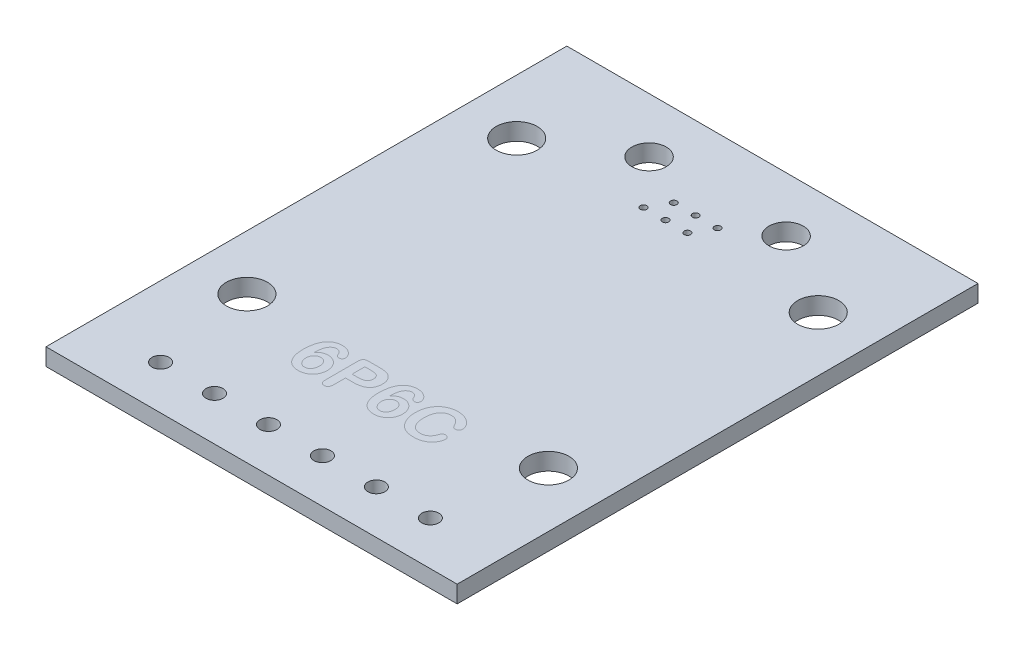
SolidWorks part; units mm, degrees
ref_plane "Front Plane" through (0, 0, 0) normal (0, 0, 1) x (1, 0, 0)
ref_plane "Top Plane" through (0, 0, 0) normal (0, 1, 0) x (1, 0, 0)
ref_plane "Right Plane" through (0, 0, 0) normal (1, 0, 0) x (0, 0, -1)
sketch "Sketch1" plane through (0, 0, 0) normal (0, 1, 0) x (1, 0, 0)
  line L0 (19.05, 48.26) -> (19.05, 0) construction
  line L1 (0, 0) -> (38.1, 0)
  line L2 (0, 0) -> (0, 48.26)
  line L3 (0, 48.26) -> (38.1, 48.26)
  line L4 (38.1, 0) -> (38.1, 48.26)
  circle A0 centre (5.08, 13.535) radius 1.905
  circle A1 centre (5.08, 38.535) radius 1.905
  circle A2 centre (33.02, 13.535) radius 1.905
  circle A3 centre (33.02, 38.535) radius 1.905
  circle A4 centre (5.08, 26.035) radius 1.905 construction
  circle A5 centre (33.02, 26.035) radius 1.905 construction
  dimension "D3" = 5.08
  dimension "D4" = 12.5
  dimension "D5" = 12.5
  dimension "D6" = 3.81
  dimension "D7" = 26.035
  dimension "D1" = 38.1
  dimension "D2" = 48.26
extrude "Boss-Extrude1" add sketch "Sketch1" against normal blind 1.5875
sketch "Sketch2" plane through (0, 0, 0) normal (0, 1, 0) x (1, 0, 0)
  line L1 (0, 0) -> (38.1, 0) construction
  line L2 (6.55, 4.064) -> (11.55, 4.064) construction
  line L3 (19.05, 48.26) -> (19.05, 0) construction
  line L4 (38.1, 48.26) -> (0, 48.26) construction
  line L5 (16.55, 4.064) -> (21.55, 4.064) construction
  circle A0 centre (6.55, 4.064) radius 0.7874
  circle A1 centre (11.55, 4.064) radius 0.7874
  circle A2 centre (16.55, 4.064) radius 0.7874
  circle A3 centre (21.55, 4.064) radius 0.7874
  circle A4 centre (26.55, 4.064) radius 0.7874
  circle A5 centre (31.55, 4.064) radius 0.7874
  point P2 (19.05, 4.064)
  dimension "D2" = 4.064
  dimension "D5" = 1.5748
  dimension "D4" = 5
  dimension "D3" = 6
extrude "screwHoles" cut sketch "Sketch2" against normal through all
sketch "Sketch3" plane through (0, 0, 0) normal (0, 1, 0) x (1, 0, 0)
  line L2 (19.05, 48.26) -> (19.05, 0) construction
  line L3 (38.1, 48.26) -> (0, 48.26) construction
  line L4 (0, 0) -> (38.1, 0) construction
  circle A0 centre (12.7, 43.18) radius 1.59
  circle A1 centre (25.4, 43.18) radius 1.59
  dimension "D1" = 3.18
  dimension "D3" = 5.08
  dimension "D2" = 12.7
extrude "Cut-Extrude2" cut sketch "Sketch3" against normal through all
sketch "Sketch4" plane through (0, 0, 0) normal (0, 1, 0) x (1, 0, 0)
  line L0 (0, 9.8298) -> (38.1, 9.8298) construction
  line L1 (0, 48.26) -> (0, 0) construction
  line L2 (38.1, 0) -> (38.1, 48.26) construction
  line L3 (0, 0) -> (38.1, 0) construction
  text T0 "6P6C" font "Arial Rounded MT Bold" height in points 16
  dimension "D1" = 9.8298
ref_plane "Plane2" [suppressed] through (19.05, 0, 0) normal (1, 0, 0) x (0, 0, -1)
sketch "Sketch5" plane through (0, -1.5875, 0) normal (0, -1, 0) x (1, 0, 0)
  line L0 (16.51, -38.6715) -> (16.51, -39.0525) construction
  line L1 (16.2814, -38.6715) -> (16.7386, -38.6715) construction
  line L2 (16.7386, -39.0525) -> (16.2814, -39.0525) construction
  line L3 (18.542, -38.6715) -> (18.542, -39.0525) construction
  line L4 (18.7706, -38.6715) -> (18.3134, -38.6715) construction
  line L5 (18.7706, -39.0525) -> (18.3134, -39.0525) construction
  line L6 (20.574, -38.6715) -> (20.574, -39.0525) construction
  line L7 (20.8026, -38.6715) -> (20.3454, -38.6715) construction
  line L8 (20.8026, -39.0525) -> (20.3454, -39.0525) construction
  line L9 (17.526, -40.4495) -> (17.526, -40.8305) construction
  line L10 (17.2974, -40.4495) -> (17.7546, -40.4495) construction
  line L11 (17.7546, -40.8305) -> (17.2974, -40.8305) construction
  line L12 (19.558, -40.4495) -> (19.558, -40.8305) construction
  line L13 (19.7866, -40.4495) -> (19.3294, -40.4495) construction
  line L14 (19.7866, -40.8305) -> (19.3294, -40.8305) construction
  line L15 (21.59, -40.4495) -> (21.59, -40.8305) construction
  line L16 (21.8186, -40.4495) -> (21.3614, -40.4495) construction
  line L17 (21.8186, -40.8305) -> (21.3614, -40.8305) construction
  line L18 (16.51, -39.0525) -> (16.7386, -39.0525) construction
  circle A0 centre (16.51, -38.862) radius 0.2976
  circle A1 centre (18.542, -38.862) radius 0.2976
  circle A2 centre (20.574, -38.862) radius 0.2976
  circle A3 centre (17.526, -40.64) radius 0.2976
  circle A4 centre (19.558, -40.64) radius 0.2976
  circle A5 centre (21.59, -40.64) radius 0.2976
extrude "Cut-Extrude3" cut sketch "Sketch5" against normal through all
